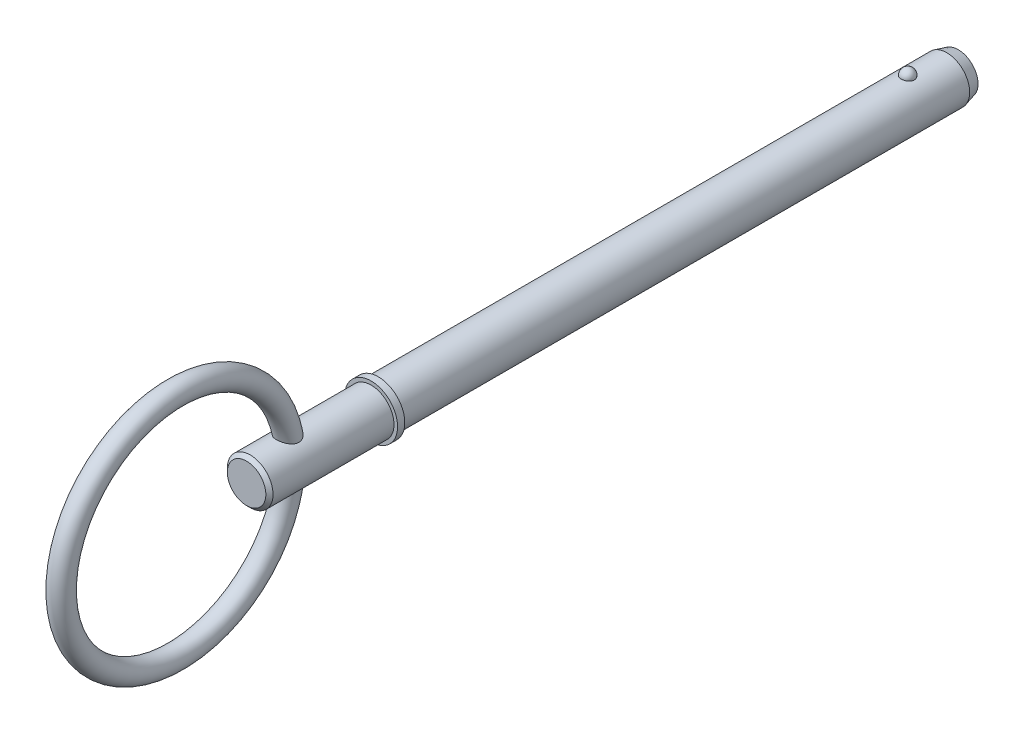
SolidWorks part; units mm, degrees
ref_plane "Front Plane" through (0, 0, 0) normal (0, 0, 1) x (1, 0, 0)
ref_plane "Top Plane" through (0, 0, 0) normal (0, 1, 0) x (1, 0, 0)
ref_plane "Right Plane" through (0, 0, 0) normal (1, 0, 0) x (0, 0, -1)
sketch "Sketch2" plane through (0, 0, 0) normal (0, 0, 1) x (1, 0, 0)
  circle A0 centre (0, 0) radius 3.175
  point P3 (0, 3.175)
  dimension "D1" = 6.35
extrude "Boss-Extrude1" add sketch "Sketch2" along normal blind 72.6
sketch "Sketch3" plane through (0, 0, 0) normal (0, 0, -1) x (-1, 0, 0)
  circle A0 centre (0, 0) radius 3.175
  dimension "D1" = 6.35
extrude "Boss-Extrude2" add sketch "Sketch3" along normal blind 7.92
chamfer "Chamfer1" distance 1.586 angle 15 1 edges at (-3.175, 0, -7.92)
sketch "Sketch18" plane through (0, 0, 0) normal (1, 0, 0) x (0, 0, -1)
  line L0 (6.334, 3.175) -> (-72.6, 3.175) construction
  line L1 (0.91, 4.085) -> (0.91, 2.265)
  line L2 (-72.6, -3.175) -> (6.334, -3.175) construction
  arc A0 (0.91, 4.085) -> (0.91, 2.265) centre (0.91, 3.175) ccw
  point P4 (0, 3.175)
  dimension "D1" = 7.26
revolve "Revolve1" add sketch "Sketch18" angle 360 about L1
sketch "Sketch19" plane through (0, 0, 0) normal (1, 0, 0) x (0, 0, -1)
  line L0 (-33.7288, 0) -> (-46.4542, 0) construction
sketch "Sketch20" plane through (0, 0, 0) normal (1, 0, 0) x (0, 0, -1)
  line L0 (-72.6, 0) -> (-72.6, 3.675)
  line L1 (-72.6, 3.175) -> (-72.6, -3.175) construction
  line L2 (-72.6, 3.675) -> (-73.6, 3.675)
  line L3 (-73.6, 3.675) -> (-73.6, 0)
  line L4 (-33.7288, 0) -> (-46.4542, 0) construction
  line L5 (-73.6, 0) -> (-72.6, 0)
  dimension "D1" = 3.675
  dimension "D2" = 1
revolve "Revolve2" add sketch "Sketch20" angle 360 about L0
sketch "Sketch21" plane through (0, 0, 72.6) normal (0, 0, -1) x (-1, 0, 0)
  circle A0 centre (0, 0) radius 3.175
  dimension "D1" = 6.35
extrude "Boss-Extrude3" add sketch "Sketch21" against normal blind 18.29
chamfer "Chamfer2" distance 0.5 angle 45 1 edges at (-3.175, 0, 90.89)
sketch "Sketch23" plane through (0, 0, 0) normal (1, 0, 0) x (0, 0, -1)
  line L0 (-90.89, 2.675) -> (-90.89, -2.675) construction
  circle A0 centre (-100.765, 0) radius 15.875
  point P2 (-84.89, 0)
  dimension "D1" = 31.75
  dimension "D2" = 6
sketch "Sketch24" plane through (0, 0, 0) normal (0, 1, 0) x (1, 0, 0)
  circle A0 centre (0, -84.89) radius 1.5
  dimension "D1" = 3
sweep "Sweep1" add profiles "Sketch24" path "Sketch23"
